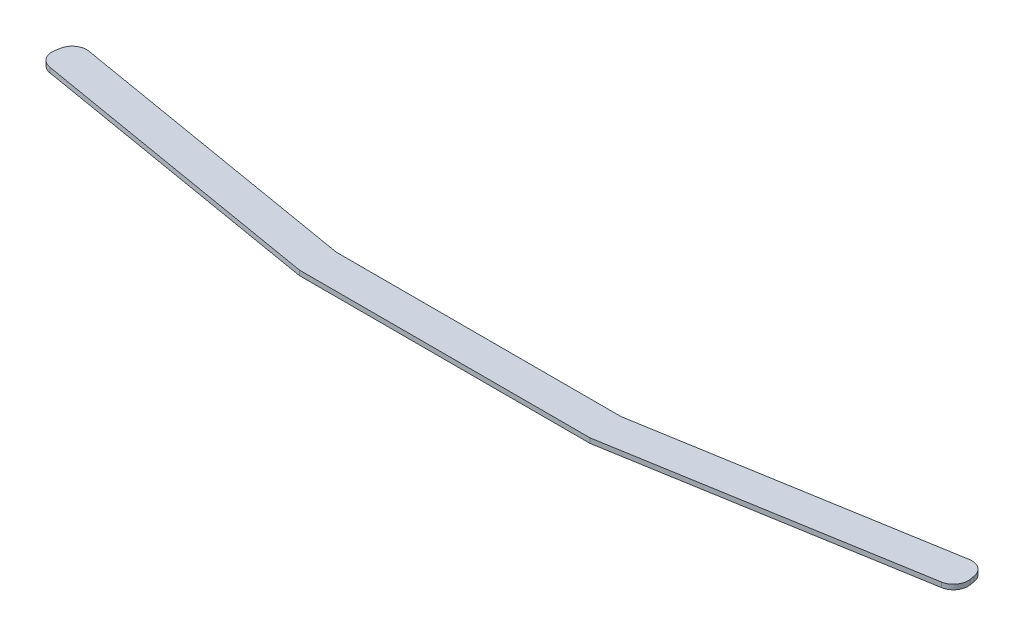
SolidWorks part; units mm, degrees
ref_plane "Спереди" through (0, 0, 0) normal (0, 0, 1) x (1, 0, 0)
ref_plane "Сверху" through (0, 0, 0) normal (0, 1, 0) x (1, 0, 0)
ref_plane "Справа" through (0, 0, 0) normal (1, 0, 0) x (0, 0, -1)
sketch "Эскиз1" plane through (0, 0, 0) normal (0, 1, 0) x (1, 0, 0)
  line L1 (-30, 0) -> (30, 0)
  line L2 (30, 0) -> (92.0421, 10.4994)
  line L3 (29.4119, 7) -> (90.874, 17.4013)
  line L4 (94.4994, 13.9579) -> (94.3326, 14.9439)
  line L5 (-29.4119, 7) -> (29.4119, 7)
  line L6 (-94.4994, 13.9579) -> (-94.3326, 14.9439)
  line L7 (-29.4119, 7) -> (-90.874, 17.4013)
  line L8 (-30, 0) -> (-92.0421, 10.4994)
  arc A0 (92.0421, 10.4994) -> (94.4994, 13.9579) centre (91.5415, 13.4574) ccw
  arc A1 (94.3326, 14.9439) -> (90.874, 17.4013) centre (91.3746, 14.4433) ccw
  arc A2 (-94.3326, 14.9439) -> (-90.874, 17.4013) centre (-91.3746, 14.4433) cw
  arc A3 (-92.0421, 10.4994) -> (-94.4994, 13.9579) centre (-91.5415, 13.4574) cw
  point P11 (95, 11)
  dimension "D2" = 3
  dimension "D1" = 7
extrude "Бобышка-Вытянуть1" add sketch "Эскиз1" along normal blind 1
